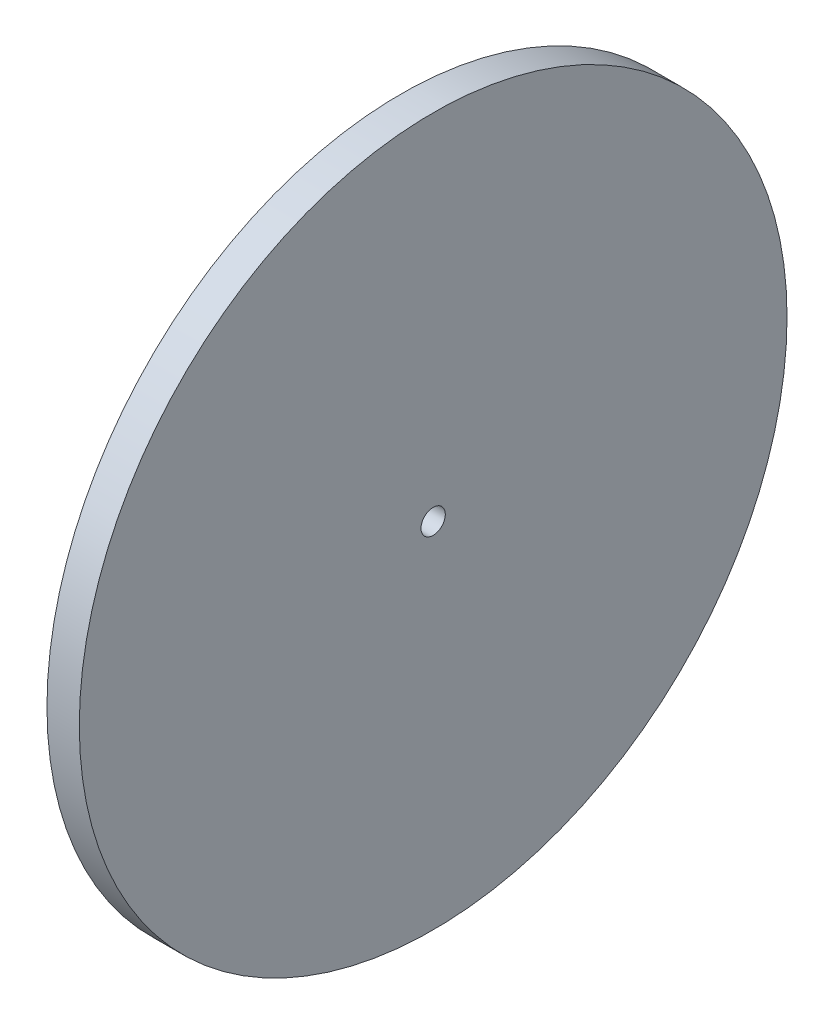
SolidWorks part; units mm, degrees
ref_plane "Plan de face" through (0, 0, 0) normal (0, 0, 1) x (1, 0, 0)
ref_plane "Plan de dessus" through (0, 0, 0) normal (0, 1, 0) x (1, 0, 0)
ref_plane "Plan de droite" through (0, 0, 0) normal (1, 0, 0) x (0, 0, -1)
sketch "Esquisse1" plane through (0, 0, 0) normal (1, 0, 0) x (0, 0, -1)
  circle A0 centre (0, 0) radius 87.535
  circle A1 centre (0, 0) radius 3
extrude "Boss.-Extru.1" add sketch "Esquisse1" along normal blind 8
